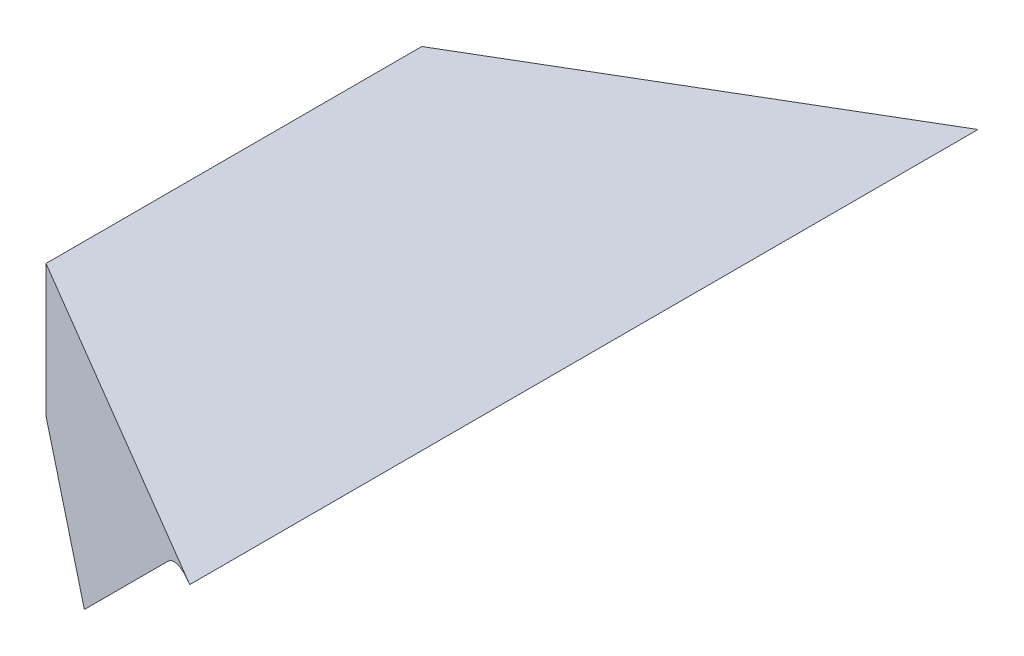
SolidWorks part; units mm, degrees
ref_plane "Plane1" through (0, 0, 0) normal (0, 0, 1) x (1, 0, 0)
ref_plane "Plane2" through (0, 0, 0) normal (0, 1, 0) x (1, 0, 0)
ref_plane "Plane3" through (0, 0, 0) normal (1, 0, 0) x (0, 0, -1)
sketch "Sketch1" plane through (0, 0, 0) normal (0, 0, 1) x (1, 0, 0)
  line L0 (-25, 5) -> (25, 5)
  line L1 (-25, 5) -> (-25, 0)
  line L2 (25, 0) -> (-25, 0)
  line L3 (25, 0) -> (25, 5)
  line L4 (0, 5) -> (0, 0) construction
  line L5 (50, 0) -> (-50, 0) construction
  dimension "D1" = 50
  dimension "D2" = 5
extrude "Base-Extrude" add sketch "Sketch1" along normal mid plane 50
sketch "Sketch2" plane through (0, 0, 0) normal (0, 0, 1) x (1, 0, 0)
  line L0 (8.4853, 0) -> (-3.5147, -12)
  line L1 (8.4853, 0) -> (-8.4853, 0)
  line L2 (-8.4853, 0) -> (-8.4853, -7.0294)
  line L3 (0, 0) -> (0, -8.4853) construction
  line L4 (25, 0) -> (-25, 0) construction
  line L5 (-3.5147, -12) -> (-8.4853, -7.0294)
  line L6 (0, -50) -> (0, 50) construction
  arc A0 (-3.5147, -12) -> (-8.4853, 0) centre (8.4853, 0) cw construction
  dimension "Bend Angle" = 45
  dimension "Height from Drop Face" = 12
extrude "Boss-Extrude1" add sketch "Sketch2" along normal mid plane 40
sketch "Sketch4" plane through (0, 0, 0) normal (0, -1, 0) x (1, 0, 0)
  line L0 (8.4853, -20) -> (-8.4853, -10)
  line L2 (-8.4853, -10) -> (-8.4853, -20)
  line L3 (-8.4853, -20) -> (8.4853, -20)
  line L4 (6.1626, 0) -> (-15.1766, 0) construction
  line L5 (-8.4853, 20) -> (8.4853, 20)
  line L6 (-8.4853, 10) -> (-8.4853, 20)
  line L7 (8.4853, 20) -> (-8.4853, 10)
  dimension "Smaller Depth" = 20
extrude "Cut-Extrude2" cut sketch "Sketch4" along normal through all
fillet "Fillet1" radius 4 1 edges at (8.4853, 0, 0)
sketch "Sketch5" plane through (25, 0, 0) normal (1, 0, 0) x (0, 0, -1)
  line L4 (25, 5) -> (-25, 5)
  line L5 (-25, 5) -> (-25, 0)
  line L6 (-25, 0) -> (25, 0)
  line L7 (25, 0) -> (25, 5)
  line L8 (25, 5) -> (-25, 5)
  line L9 (-25, 5) -> (-25, 0)
  line L10 (-25, 0) -> (25, 0)
  line L11 (25, 0) -> (25, 5)
  dimension "D1" = 0
extrude "Cut-Extrude3" cut sketch "Sketch5" against normal through all
sketch "Orientation sketch" plane through (0, 0, 0) normal (0, 1, 0) x (-1, 0, 0)
  line L4 (8.4853, 10) -> (-10.1421, 20.9763)
  line L5 (-10.1421, 20.9763) -> (-10.1421, -20.9763)
  line L6 (-10.1421, -20.9763) -> (8.4853, -10)
  line L7 (8.4853, -10) -> (8.4853, 10)
  line L8 (8.4853, 10) -> (-10.1421, 20.9763)
  line L9 (-10.1421, 20.9763) -> (-10.1421, -20.9763)
  line L10 (-10.1421, -20.9763) -> (8.4853, -10)
  line L11 (8.4853, -10) -> (8.4853, 10)
  dimension "D1" = 0
